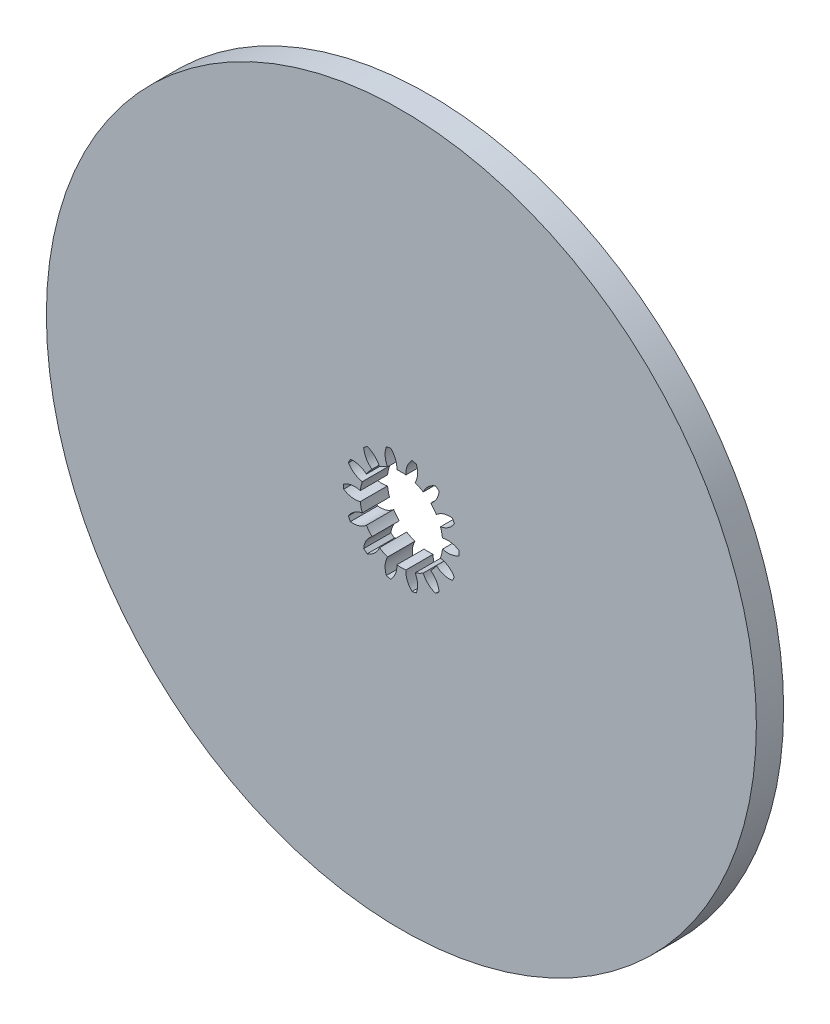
SolidWorks part; units mm, degrees
ref_plane "Front" through (0, 0, 0) normal (0, 0, 1) x (1, 0, 0)
ref_plane "Top" through (0, 0, 0) normal (0, 1, 0) x (1, 0, 0)
ref_plane "Right" through (0, 0, 0) normal (1, 0, 0) x (0, 0, -1)
sketch "Sketch1" plane through (0, 0, 0) normal (0, 0, 1) x (1, 0, 0)
  circle A0 centre (0, 0) radius 39.06
  arc A57 (3.848, -2.4335) -> (5.6097, -2.9756) centre (5.3237, -0.7715) ccw
  arc A58 (3.2288, -3.2101) -> (3.848, -2.4335) centre (0, 0) ccw
  arc A59 (4.1492, -4.8069) -> (3.2288, -3.2101) centre (1.9368, -5.0185) ccw
  arc A60 (3.7631, -5.1148) -> (4.1492, -4.8069) centre (0, 0) ccw
  arc A61 (2.4111, -3.8621) -> (3.7631, -5.1148) centre (4.4617, -3.005) ccw
  arc A62 (1.5162, -4.2931) -> (2.4111, -3.8621) centre (0, 0) ccw
  arc A63 (1.6527, -6.1312) -> (1.5162, -4.2931) centre (-0.4324, -5.3619) ccw
  arc A64 (1.1712, -6.2411) -> (1.6527, -6.1312) centre (0, 0) ccw
  arc A65 (0.4966, -4.5258) -> (1.1712, -6.2411) centre (2.716, -4.6432) ccw
  arc A66 (-0.4966, -4.5258) -> (0.4966, -4.5258) centre (0, 0) ccw
  arc A67 (-1.1712, -6.2411) -> (-0.4966, -4.5258) centre (-2.716, -4.6432) ccw
  arc A68 (-1.6527, -6.1312) -> (-1.1712, -6.2411) centre (0, 0) ccw
  arc A69 (-1.5162, -4.2931) -> (-1.6527, -6.1312) centre (0.4324, -5.3619) ccw
  arc A70 (-2.4111, -3.8621) -> (-1.5162, -4.2931) centre (0, 0) ccw
  arc A71 (-3.7631, -5.1148) -> (-2.4111, -3.8621) centre (-4.4617, -3.005) ccw
  arc A72 (-4.1492, -4.8069) -> (-3.7631, -5.1148) centre (0, 0) ccw
  arc A73 (-3.2288, -3.2101) -> (-4.1492, -4.8069) centre (-1.9368, -5.0185) ccw
  arc A74 (-3.848, -2.4335) -> (-3.2288, -3.2101) centre (0, 0) ccw
  arc A75 (-5.6097, -2.9756) -> (-3.848, -2.4335) centre (-5.3237, -0.7715) ccw
  arc A76 (-5.824, -2.5306) -> (-5.6097, -2.9756) centre (0, 0) ccw
  arc A77 (-4.3018, -1.4913) -> (-5.824, -2.5306) centre (-3.9225, -3.6811) ccw
  arc A78 (-4.5228, -0.5229) -> (-4.3018, -1.4913) centre (0, 0) ccw
  arc A79 (-6.3452, -0.2469) -> (-4.5228, -0.5229) centre (-5.1312, 1.6147) ccw
  arc A80 (-6.3452, 0.2469) -> (-6.3452, -0.2469) centre (0, 0) ccw
  arc A81 (-4.5228, 0.5229) -> (-6.3452, 0.2469) centre (-5.1312, -1.6147) ccw
  arc A82 (-4.3018, 1.4913) -> (-4.5228, 0.5229) centre (0, 0) ccw
  arc A83 (-5.824, 2.5306) -> (-4.3018, 1.4913) centre (-3.9225, 3.6811) ccw
  arc A84 (-5.6097, 2.9756) -> (-5.824, 2.5306) centre (0, 0) ccw
  arc A85 (-3.848, 2.4335) -> (-5.6097, 2.9756) centre (-5.3237, 0.7715) ccw
  arc A86 (-3.2288, 3.2101) -> (-3.848, 2.4335) centre (0, 0) ccw
  arc A87 (-4.1492, 4.8069) -> (-3.2288, 3.2101) centre (-1.9368, 5.0185) ccw
  arc A88 (-3.7631, 5.1148) -> (-4.1492, 4.8069) centre (0, 0) ccw
  arc A89 (-2.4111, 3.8621) -> (-3.7631, 5.1148) centre (-4.4617, 3.005) ccw
  arc A90 (-1.5162, 4.2931) -> (-2.4111, 3.8621) centre (0, 0) ccw
  arc A91 (-1.6527, 6.1312) -> (-1.5162, 4.2931) centre (0.4324, 5.3619) ccw
  arc A92 (-1.1712, 6.2411) -> (-1.6527, 6.1312) centre (0, 0) ccw
  arc A93 (-0.4966, 4.5258) -> (-1.1712, 6.2411) centre (-2.716, 4.6432) ccw
  arc A94 (0.4966, 4.5258) -> (-0.4966, 4.5258) centre (0, 0) ccw
  arc A95 (1.1712, 6.2411) -> (0.4966, 4.5258) centre (2.716, 4.6432) ccw
  arc A96 (1.6527, 6.1312) -> (1.1712, 6.2411) centre (0, 0) ccw
  arc A97 (1.5162, 4.2931) -> (1.6527, 6.1312) centre (-0.4324, 5.3619) ccw
  arc A98 (2.4111, 3.8621) -> (1.5162, 4.2931) centre (0, 0) ccw
  arc A99 (3.7631, 5.1148) -> (2.4111, 3.8621) centre (4.4617, 3.005) ccw
  arc A100 (4.1492, 4.8069) -> (3.7631, 5.1148) centre (0, 0) ccw
  arc A101 (3.2288, 3.2101) -> (4.1492, 4.8069) centre (1.9368, 5.0185) ccw
  arc A102 (3.848, 2.4335) -> (3.2288, 3.2101) centre (0, 0) ccw
  arc A103 (5.6097, 2.9756) -> (3.848, 2.4335) centre (5.3237, 0.7715) ccw
  arc A104 (5.824, 2.5306) -> (5.6097, 2.9756) centre (0, 0) ccw
  arc A105 (4.3018, 1.4913) -> (5.824, 2.5306) centre (3.9225, 3.6811) ccw
  arc A106 (4.5228, 0.5229) -> (4.3018, 1.4913) centre (0, 0) ccw
  arc A107 (6.3452, 0.2469) -> (4.5228, 0.5229) centre (5.1312, -1.6147) ccw
  arc A108 (6.3452, -0.2469) -> (6.3452, 0.2469) centre (0, 0) ccw
  arc A109 (4.5228, -0.5229) -> (6.3452, -0.2469) centre (5.1312, 1.6147) ccw
  arc A110 (4.3018, -1.4913) -> (4.5228, -0.5229) centre (0, 0) ccw
  arc A111 (5.824, -2.5306) -> (4.3018, -1.4913) centre (3.9225, -3.6811) ccw
  arc A112 (5.6097, -2.9756) -> (5.824, -2.5306) centre (0, 0) ccw
  arc A113 (3.848, -2.4335) -> (5.6097, -2.9756) centre (5.3237, -0.7715) ccw
  arc A114 (3.2288, -3.2101) -> (3.848, -2.4335) centre (0, 0) ccw
  arc A115 (4.1492, -4.8069) -> (3.2288, -3.2101) centre (1.9368, -5.0185) ccw
  arc A116 (3.7631, -5.1148) -> (4.1492, -4.8069) centre (0, 0) ccw
  arc A117 (2.4111, -3.8621) -> (3.7631, -5.1148) centre (4.4617, -3.005) ccw
  arc A118 (1.5162, -4.2931) -> (2.4111, -3.8621) centre (0, 0) ccw
  arc A119 (1.6527, -6.1312) -> (1.5162, -4.2931) centre (-0.4324, -5.3619) ccw
  arc A120 (1.1712, -6.2411) -> (1.6527, -6.1312) centre (0, 0) ccw
  arc A121 (0.4966, -4.5258) -> (1.1712, -6.2411) centre (2.716, -4.6432) ccw
  arc A122 (-0.4966, -4.5258) -> (0.4966, -4.5258) centre (0, 0) ccw
  arc A123 (-1.1712, -6.2411) -> (-0.4966, -4.5258) centre (-2.716, -4.6432) ccw
  arc A124 (-1.6527, -6.1312) -> (-1.1712, -6.2411) centre (0, 0) ccw
  arc A125 (-1.5162, -4.2931) -> (-1.6527, -6.1312) centre (0.4324, -5.3619) ccw
  arc A126 (-2.4111, -3.8621) -> (-1.5162, -4.2931) centre (0, 0) ccw
  arc A127 (-3.7631, -5.1148) -> (-2.4111, -3.8621) centre (-4.4617, -3.005) ccw
  arc A128 (-4.1492, -4.8069) -> (-3.7631, -5.1148) centre (0, 0) ccw
  arc A129 (-3.2288, -3.2101) -> (-4.1492, -4.8069) centre (-1.9368, -5.0185) ccw
  arc A130 (-3.848, -2.4335) -> (-3.2288, -3.2101) centre (0, 0) ccw
  arc A131 (-5.6097, -2.9756) -> (-3.848, -2.4335) centre (-5.3237, -0.7715) ccw
  arc A132 (-5.824, -2.5306) -> (-5.6097, -2.9756) centre (0, 0) ccw
  arc A133 (-4.3018, -1.4913) -> (-5.824, -2.5306) centre (-3.9225, -3.6811) ccw
  arc A134 (-4.5228, -0.5229) -> (-4.3018, -1.4913) centre (0, 0) ccw
  arc A135 (-6.3452, -0.2469) -> (-4.5228, -0.5229) centre (-5.1312, 1.6147) ccw
  arc A136 (-6.3452, 0.2469) -> (-6.3452, -0.2469) centre (0, 0) ccw
  arc A137 (-4.5228, 0.5229) -> (-6.3452, 0.2469) centre (-5.1312, -1.6147) ccw
  arc A138 (-4.3018, 1.4913) -> (-4.5228, 0.5229) centre (0, 0) ccw
  arc A139 (-5.824, 2.5306) -> (-4.3018, 1.4913) centre (-3.9225, 3.6811) ccw
  arc A140 (-5.6097, 2.9756) -> (-5.824, 2.5306) centre (0, 0) ccw
  arc A141 (-3.848, 2.4335) -> (-5.6097, 2.9756) centre (-5.3237, 0.7715) ccw
  arc A142 (-3.2288, 3.2101) -> (-3.848, 2.4335) centre (0, 0) ccw
  arc A143 (-4.1492, 4.8069) -> (-3.2288, 3.2101) centre (-1.9368, 5.0185) ccw
  arc A144 (-3.7631, 5.1148) -> (-4.1492, 4.8069) centre (0, 0) ccw
  arc A145 (-2.4111, 3.8621) -> (-3.7631, 5.1148) centre (-4.4617, 3.005) ccw
  arc A146 (-1.5162, 4.2931) -> (-2.4111, 3.8621) centre (0, 0) ccw
  arc A147 (-1.6527, 6.1312) -> (-1.5162, 4.2931) centre (0.4324, 5.3619) ccw
  arc A148 (-1.1712, 6.2411) -> (-1.6527, 6.1312) centre (0, 0) ccw
  arc A149 (-0.4966, 4.5258) -> (-1.1712, 6.2411) centre (-2.716, 4.6432) ccw
  arc A150 (0.4966, 4.5258) -> (-0.4966, 4.5258) centre (0, 0) ccw
  arc A151 (1.1712, 6.2411) -> (0.4966, 4.5258) centre (2.716, 4.6432) ccw
  arc A152 (1.6527, 6.1312) -> (1.1712, 6.2411) centre (0, 0) ccw
  arc A153 (1.5162, 4.2931) -> (1.6527, 6.1312) centre (-0.4324, 5.3619) ccw
  arc A154 (2.4111, 3.8621) -> (1.5162, 4.2931) centre (0, 0) ccw
  arc A155 (3.7631, 5.1148) -> (2.4111, 3.8621) centre (4.4617, 3.005) ccw
  arc A156 (4.1492, 4.8069) -> (3.7631, 5.1148) centre (0, 0) ccw
  arc A157 (3.2288, 3.2101) -> (4.1492, 4.8069) centre (1.9368, 5.0185) ccw
  arc A158 (3.848, 2.4335) -> (3.2288, 3.2101) centre (0, 0) ccw
  arc A159 (5.6097, 2.9756) -> (3.848, 2.4335) centre (5.3237, 0.7715) ccw
  arc A160 (5.824, 2.5306) -> (5.6097, 2.9756) centre (0, 0) ccw
  arc A161 (4.3018, 1.4913) -> (5.824, 2.5306) centre (3.9225, 3.6811) ccw
  arc A162 (4.5228, 0.5229) -> (4.3018, 1.4913) centre (0, 0) ccw
  arc A163 (6.3452, 0.2469) -> (4.5228, 0.5229) centre (5.1312, -1.6147) ccw
  arc A164 (6.3452, -0.2469) -> (6.3452, 0.2469) centre (0, 0) ccw
  arc A165 (4.5228, -0.5229) -> (6.3452, -0.2469) centre (5.1312, 1.6147) ccw
  arc A166 (4.3018, -1.4913) -> (4.5228, -0.5229) centre (0, 0) ccw
  arc A167 (5.824, -2.5306) -> (4.3018, -1.4913) centre (3.9225, -3.6811) ccw
  arc A168 (5.6097, -2.9756) -> (5.824, -2.5306) centre (0, 0) ccw
  dimension "D1" = 78.12
  dimension "D2" = 0
extrude "Boss-Extrude1" add sketch "Sketch1" against normal blind 3
